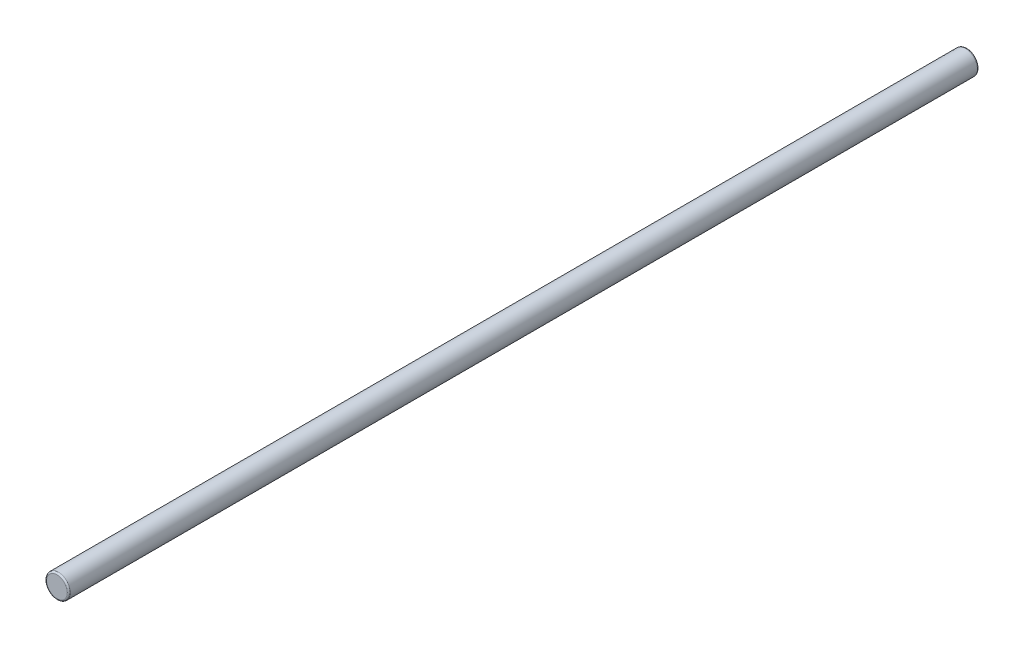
SolidWorks part; units mm, degrees
ref_plane "Front Plane" through (0, 0, 0) normal (0, 0, 1) x (1, 0, 0)
ref_plane "Top Plane" through (0, 0, 0) normal (0, 1, 0) x (1, 0, 0)
ref_plane "Right Plane" through (0, 0, 0) normal (1, 0, 0) x (0, 0, -1)
sketch "Sketch1" plane through (0, 0, 0) normal (0, 0, 1) x (1, 0, 0)
  circle A0 centre (0, 0) radius 3.9688
  dimension "D1" = 7.9375
extrude "Extrude1" add sketch "Sketch1" against normal blind 304.8
fillet "Fillet1" radius 0.508 2 edges at (3.9688, 0, 0) (3.9688, 0, -304.8)
